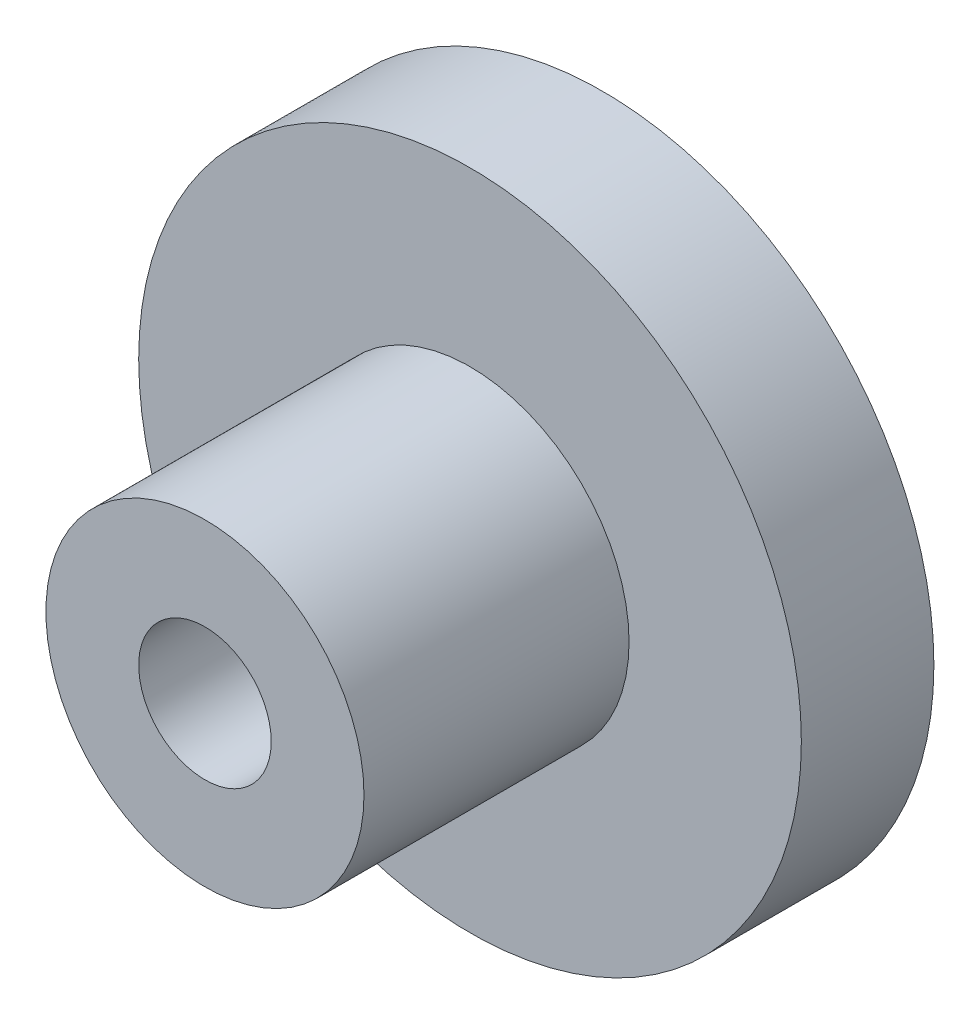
SolidWorks part; units mm, degrees
ref_plane "Płaszczyzna przednia" through (0, 0, 0) normal (0, 0, 1) x (1, 0, 0)
ref_plane "Płaszczyzna górna" through (0, 0, 0) normal (0, 1, 0) x (1, 0, 0)
ref_plane "Płaszczyzna prawa" through (0, 0, 0) normal (1, 0, 0) x (0, 0, -1)
sketch "Szkic1" plane through (0, 0, 0) normal (0, 0, 1) x (1, 0, 0)
  circle A0 centre (0, 0) radius 2.5
  circle A1 centre (0, 0) radius 12.5
  dimension "D1" = 5
  dimension "D2" = 25
extrude "Dodanie-wyciągnięcie1" add sketch "Szkic1" along normal blind 15
sketch "Szkic2" plane through (0, 0, 15) normal (0, 0, 1) x (1, 0, 0)
  circle A0 centre (0, 0) radius 6
  circle A1 centre (0, 0) radius 12.5 construction
  point P2 (0, 0)
  dimension "D1" = 12
extrude "Wytnij-wyciągnięcie1" cut sketch "Szkic2" against normal blind 10 flip side to cut
